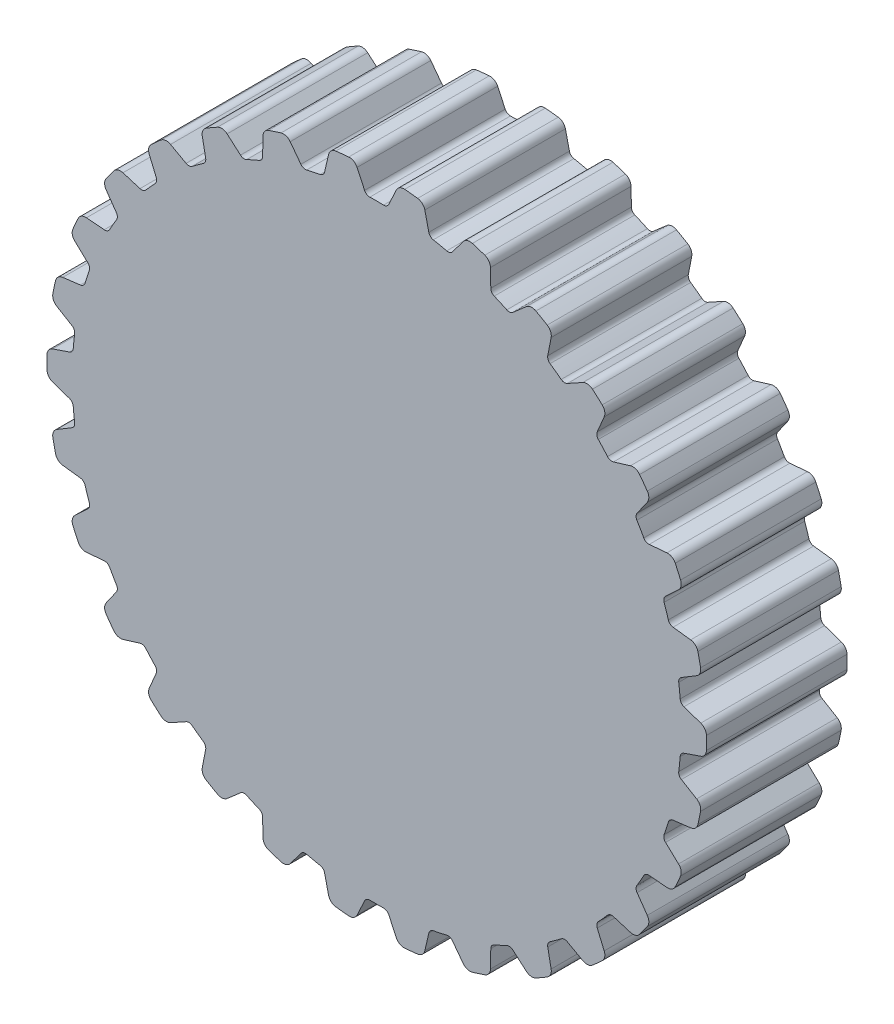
SolidWorks part; units mm, degrees
ref_plane "Front" through (0, 0, 0) normal (0, 0, 1) x (1, 0, 0)
ref_plane "Top" through (0, 0, 0) normal (0, 1, 0) x (1, 0, 0)
ref_plane "Right" through (0, 0, 0) normal (1, 0, 0) x (0, 0, -1)
sketch "Esquisse1" plane through (0, 0, 0) normal (0, 0, 1) x (1, 0, 0)
  line L0 (-58.3557, 29.8876) -> (-28.3557, 29.8876) construction
  line L1 (0, 0) -> (0, 23.8732) construction
  line L2 (-1.3954, 23.0293) -> (-0.8611, 21.8835)
  line L3 (1.3954, 23.0293) -> (0.8611, 21.8835)
  line L4 (0, 0) -> (-2.452, 23.3297)
  line L5 (0, 0) -> (2.452, 23.3297)
  circle A0 centre (0, 0) radius 23.8732 construction
  circle A1 centre (0, 0) radius 23.4582 construction
  arc A2 (0.4896, 21.6527) -> (-0.4896, 21.6527) centre (0, 0) ccw
  arc A3 (-2.452, 23.3297) -> (-1.9901, 23.3736) centre (0, 0) cw
  arc A4 (2.452, 23.3297) -> (1.9901, 23.3736) centre (0, 0) ccw
  arc A5 (1.3954, 23.0293) -> (1.9901, 23.3736) centre (1.9392, 22.7758) cw
  arc A6 (-1.3954, 23.0293) -> (-1.9901, 23.3736) centre (-1.9392, 22.7758) ccw
  arc A7 (0.4896, 21.6527) -> (0.8611, 21.8835) centre (0.4986, 22.0525) ccw
  arc A8 (-0.4896, 21.6527) -> (-0.8611, 21.8835) centre (-0.4986, 22.0525) cw
  point P14 (1.5709, 23.4055)
  point P18 (-1.5709, 23.4055)
  point P21 (0.75, 21.6452)
  point P24 (-0.75, 21.6452)
sketch "Esquisse3" plane through (0, 0, 0) normal (0, 0, 1) x (1, 0, 0)
  line L0 (0, 0) -> (-2.452, 23.3297) construction
  line L1 (0, 0) -> (2.452, 23.3297) construction
  line L2 (1.3954, 23.0293) -> (0.8611, 21.8835) construction
  line L3 (-1.3954, 23.0293) -> (-0.8611, 21.8835) construction
  line L4 (0, 0) -> (-2.452, 23.3297)
  line L5 (0, 0) -> (2.452, 23.3297)
  line L6 (1.3954, 23.0293) -> (0.8611, 21.8835)
  line L7 (-1.3954, 23.0293) -> (-0.8611, 21.8835)
  arc A0 (2.452, 23.3297) -> (1.9901, 23.3736) centre (0, 0) ccw construction
  arc A1 (1.9901, 23.3736) -> (1.3954, 23.0293) centre (1.9392, 22.7758) ccw construction
  arc A2 (0.4896, 21.6527) -> (0.8611, 21.8835) centre (0.4986, 22.0525) ccw construction
  arc A3 (0.4896, 21.6527) -> (-0.4896, 21.6527) centre (0, 0) ccw construction
  arc A4 (-0.8611, 21.8835) -> (-0.4896, 21.6527) centre (-0.4986, 22.0525) ccw construction
  arc A5 (-1.3954, 23.0293) -> (-1.9901, 23.3736) centre (-1.9392, 22.7758) ccw construction
  arc A6 (-1.9901, 23.3736) -> (-2.452, 23.3297) centre (0, 0) ccw construction
  arc A7 (2.452, 23.3297) -> (1.9901, 23.3736) centre (0, 0) ccw
  arc A8 (1.9901, 23.3736) -> (1.3954, 23.0293) centre (1.9392, 22.7758) ccw
  arc A9 (0.4896, 21.6527) -> (0.8611, 21.8835) centre (0.4986, 22.0525) ccw
  arc A10 (0.4896, 21.6527) -> (-0.4896, 21.6527) centre (0, 0) ccw
  arc A11 (-0.8611, 21.8835) -> (-0.4896, 21.6527) centre (-0.4986, 22.0525) ccw
  arc A12 (-1.3954, 23.0293) -> (-1.9901, 23.3736) centre (-1.9392, 22.7758) ccw
  arc A13 (-1.9901, 23.3736) -> (-2.452, 23.3297) centre (0, 0) ccw
extrude "Boss.-Extru.1" add sketch "Esquisse3" along normal mid plane 10
pattern_circular "Répétition circulaire1" count 30 over 360 about axis through (0, 0, 0) along (0, 0, 1) of "Boss.-Extru.1"
equation "\"D2@Esquisse1\"=(\"D1@Esquisse1\"*5)/3.1416"
equation "\"D3@Esquisse1\"=\"D2@Esquisse1\"-0.83"
equation "\"D5@Esquisse1\"=\"D3@Esquisse1\"-2*1.8"
equation "\"D7@Esquisse1\"=360/\"D1@Esquisse1\""
equation "\"D1@Répétition circulaire1\"=\"D1@Esquisse1\""
